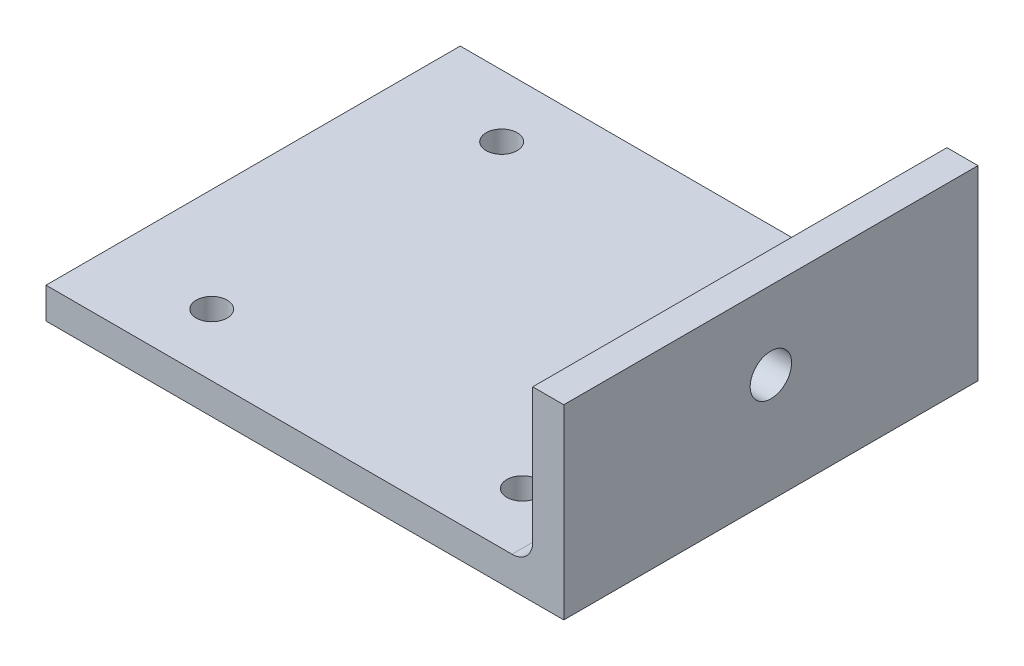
SolidWorks part; units mm, degrees
ref_plane "Plan de face" through (0, 0, 0) normal (0, 0, 1) x (1, 0, 0)
ref_plane "Plan de dessus" through (0, 0, 0) normal (0, 1, 0) x (1, 0, 0)
ref_plane "Plan de droite" through (0, 0, 0) normal (1, 0, 0) x (0, 0, -1)
sketch "Esquisse1" plane through (0, 0, 0) normal (0, 1, 0) x (1, 0, 0)
  line L0 (3.5567, -21.1902) -> (3.5567, 18.8098) construction
  line L1 (-21.4433, 17.9381) -> (28.5567, 17.9381)
  line L2 (-21.4433, 17.9381) -> (-21.4433, -22.0619)
  line L3 (-21.4433, -22.0619) -> (28.5567, -22.0619)
  line L4 (28.5567, 17.9381) -> (28.5567, -22.0619)
  line L5 (-21.4433, -2.0619) -> (28.5567, -2.0619) construction
  circle A0 centre (-11.4433, -16.0619) radius 1.5
  circle A1 centre (18.5567, -16.0619) radius 1.5
  circle A2 centre (18.5567, 11.9381) radius 1.5
  circle A3 centre (-11.4433, 11.9381) radius 1.5
  dimension "D3" = 3
  dimension "D1" = 40
  dimension "D2" = 50
  dimension "D4" = 15
  dimension "D5" = 14
extrude "Boss.-Extru.1" add sketch "Esquisse1" along normal blind 3
sketch "Esquisse2" plane through (0, 3, 0) normal (0, 1, 0) x (1, 0, 0)
  line L0 (-21.4433, -22.0619) -> (28.5567, -22.0619) construction
  line L1 (28.5567, 17.9381) -> (25.5567, 17.9381)
  line L2 (28.5567, 17.9381) -> (28.5567, -22.0619)
  line L3 (28.5567, -22.0619) -> (25.5567, -22.0619)
  line L4 (25.5567, 17.9381) -> (25.5567, -22.0619)
  dimension "D1" = 3
extrude "Boss.-Extru.2" add sketch "Esquisse2" along normal blind 15
sketch "Esquisse3" plane through (28.5567, 0, 0) normal (1, 0, 0) x (0, 0, -1)
  line L0 (-22.0619, 18) -> (17.9381, 18) construction
  circle A0 centre (-2.0619, 10.5) radius 2
  point P4 (0, 0)
  point P5 (-2.0619, 18)
  dimension "D1" = 7.5
  dimension "D2" = 4
extrude "Enlèv. mat.-Extru.1" cut sketch "Esquisse3" against normal up to next
fillet "Congé1" radius 2 1 edges at (25.5567, 3, 2.0619)
